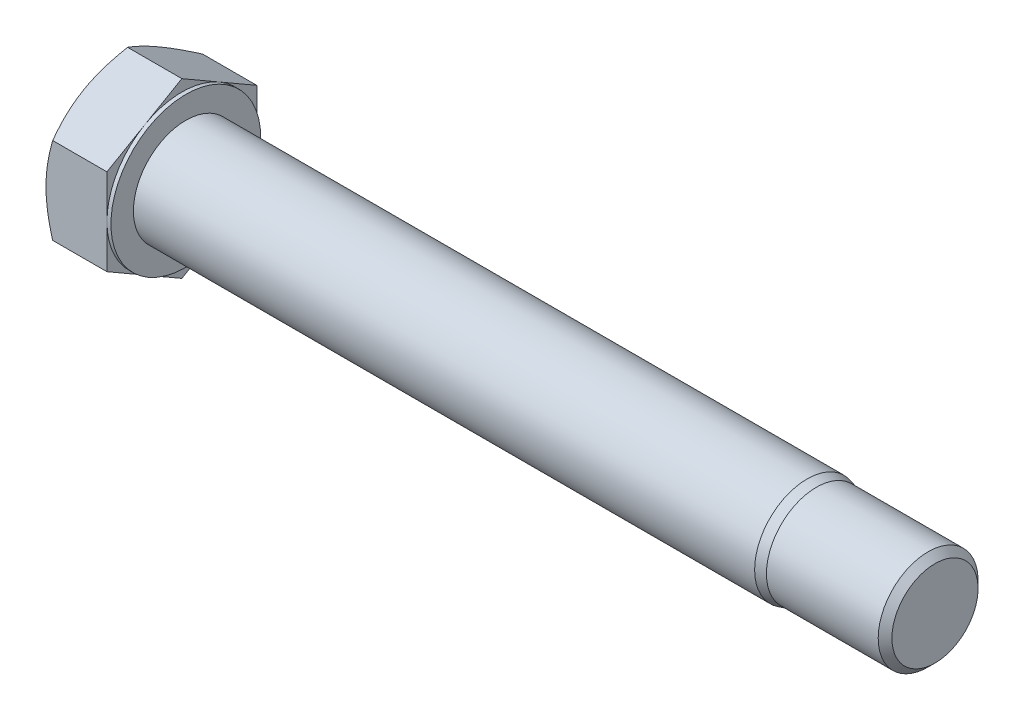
SolidWorks part; units mm, degrees
ref_plane "Plane1" through (0, 0, 0) normal (0, 0, 1) x (1, 0, 0)
ref_plane "Plane2" through (0, 0, 0) normal (0, 1, 0) x (1, 0, 0)
ref_plane "Plane3" through (0, 0, 0) normal (1, 0, 0) x (0, 0, -1)
sketch "HeadSke" plane through (0, 0, 0) normal (1, 0, 0) x (0, 0, -1)
  line L0 (15, 8.6603) -> (15, -8.6603)
  line L1 (-15, 8.6603) -> (-15, -8.6603)
  line L2 (15, -8.6603) -> (0, -17.3205)
  line L3 (0, -17.3205) -> (-15, -8.6603)
  line L4 (15, 8.6603) -> (0, 17.3205)
  line L5 (0, 17.3205) -> (-15, 8.6603)
  line L6 (0, 17.3205) -> (0, -17.3205) construction
  dimension "Width_flats" = 30
  dimension "D2" = 120
extrude "BaseHead" add sketch "HeadSke" along normal blind 13
sketch "BodySke" plane through (0, 0, 0) normal (0, 0, 1) x (1, 0, 0)
  line L0 (0, 10.5) -> (0, 0)
  line L2 (0, 0) -> (163, 0)
  line L4 (163, 0) -> (163, 8.626)
  line L5 (13, 17.3205) -> (13, 8.6603) construction
  line L6 (163, 8.626) -> (161.626, 10)
  line L7 (0, 0) -> (194.2747, 0) construction
  line L8 (163, -8.626) -> (161.626, -10) construction
  line L9 (0, -10) -> (161.626, -10) construction
  line L10 (15.5, 15.24) -> (15.5, -1.27) construction
  line L11 (139.25, 10) -> (137.384, 10.5)
  line L12 (13, 8.6603) -> (13, -8.6603) construction
  line L13 (137.384, 10.5) -> (0, 10.5)
  line L15 (139.25, 10) -> (161.626, 10)
  dimension "D1" = 75
  dimension "Length" = 150
  dimension "Diameter" = 20
  dimension "Minor_dia" = 17.252
  dimension "Advance" = 2.5
  dimension "Thread_nom" = 23.75
  dimension "Shank_dia" = 21
  dimension "body_ch_ang" = 45
revolve "BaseBody" add sketch "BodySke" angle 360 about L7
sketch "Sketch3" plane through (0, 0, 0) normal (0, 1, 0) x (1, 0, 0)
  line L0 (3.75, 21.4952) -> (-3.75, 8.5048)
  line L1 (3.75, 21.4952) -> (-6.1958, 27.2374)
  line L2 (-3.75, 8.5048) -> (-13.6958, 14.247)
  line L3 (-6.1958, 27.2374) -> (-13.6958, 14.247)
  line L4 (0, 15) -> (0, 0) construction
  line L6 (0, 0) -> (99.06, 0) construction
  dimension "Head_ch_ang" = 30
revolve "HeadChamfer" cut sketch "Sketch3" angle 360 about L6
sketch "BearingSke" plane through (0, 0, 0) normal (0, 0, 1) x (1, 0, 0)
  line L0 (13, 17.3205) -> (1.3397, 17.3205) construction
  line L1 (13, 17.3205) -> (13, 8.6603) construction
  line L2 (13, 15) -> (12.2, 15)
  line L3 (13, 15) -> (13, 17.3205)
  line L4 (13, 17.3205) -> (12.2, 17.3205)
  line L5 (0, 0) -> (95.25, 0) construction
  line L6 (0, 0) -> (194.2747, 0) construction
  line L7 (12.2, 15) -> (12.2, 17.3205)
  dimension "Bearing_ht" = 0.8
  dimension "Bearing_dia" = 30
revolve "BearingFace" cut sketch "BearingSke" angle 360 about L5
fillet "HeadFillet" [suppressed] radius 0.8
sketch "ThdSchSke" plane through (0, 0, 0) normal (0, 0, 1) x (1, 0, 0)
  line L0 (141.75, -8.626) -> (140.7879, -10)
  line L1 (141.75, -8.626) -> (142.7121, -10)
  line L2 (142.7121, -10) -> (142.7121, -12.5)
  line L3 (-3.175, 0) -> (5.1513, 0) construction
  line L5 (142.7121, -12.5) -> (140.7879, -12.5)
  line L6 (140.7879, -12.5) -> (140.7879, -10)
  dimension "Thread_minor" = 17.252
  dimension "Diameter" = 20
  dimension "Start" = 141.75
  dimension "SideAngle" = 55
  dimension "VeeAngle" = 70
  dimension "Overcut" = 25
revolve "ThreadSchematic" [suppressed] cut sketch "ThdSchSke" angle 360 about L3
pattern_linear "ThdSchPat" [suppressed]
equation "\"Thread_minor@ThreadCosmetic\" = \"Minor_dia@BodySke\""
equation "\"Thread_length@ThreadCosmetic\" = \"Thread_nom@BodySke\" - \"Advance@BodySke\""
equation "\"Thread_minor@ThdSchSke\" = \"Minor_dia@BodySke\""
equation "\"Diameter@ThdSchSke\" = \"Diameter@BodySke\""
equation "\"Overcut@ThdSchSke\" = \"Diameter@BodySke\" * 1.25"
equation "\"Start@ThdSchSke\" = \"Head_ht@BaseHead\" + \"Length@BodySke\" - \"Thread_length@ThreadCosmetic\"  '---Non-countersunk---"
equation "\"Num_threads@ThdSchPat\" = int( \"Thread_length@ThreadCosmetic\" / \"Advance@BodySke\" + 0.999 )  + 1"
equation "\"Advance@ThdSchPat\" = \"Thread_length@ThreadCosmetic\" /  (\"Num_threads@ThdSchPat\" - 1) 'relax it"
equation "\"Num_threads@ThdSchPat\" = \"Num_threads@ThdSchPat\" - sgn( \"Num_threads@ThdSchPat\" - 1) '---chamfered tips only---"
